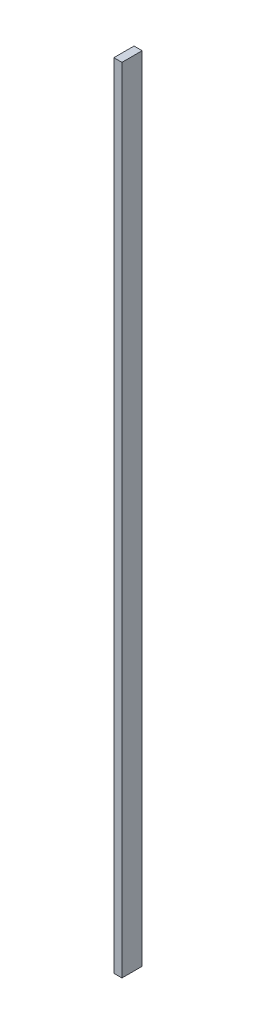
SolidWorks part; units mm, degrees
ref_plane "Plan de face" through (0, 0, 0) normal (0, 0, 1) x (1, 0, 0)
ref_plane "Plan de dessus" through (0, 0, 0) normal (0, 1, 0) x (1, 0, 0)
ref_plane "Plan de droite" through (0, 0, 0) normal (1, 0, 0) x (0, 0, -1)
sketch "Esquisse1" plane through (0, 0, 0) normal (0, 1, 0) x (1, 0, 0)
  line L1 (0, 0) -> (20, 0)
  line L2 (0, 0) -> (0, 50)
  line L3 (0, 50) -> (20, 50)
  line L4 (20, 0) -> (20, 50)
  dimension "D1" = 20
  dimension "D2" = 50
extrude "Extrusion1" add sketch "Esquisse1" along normal blind 1960
